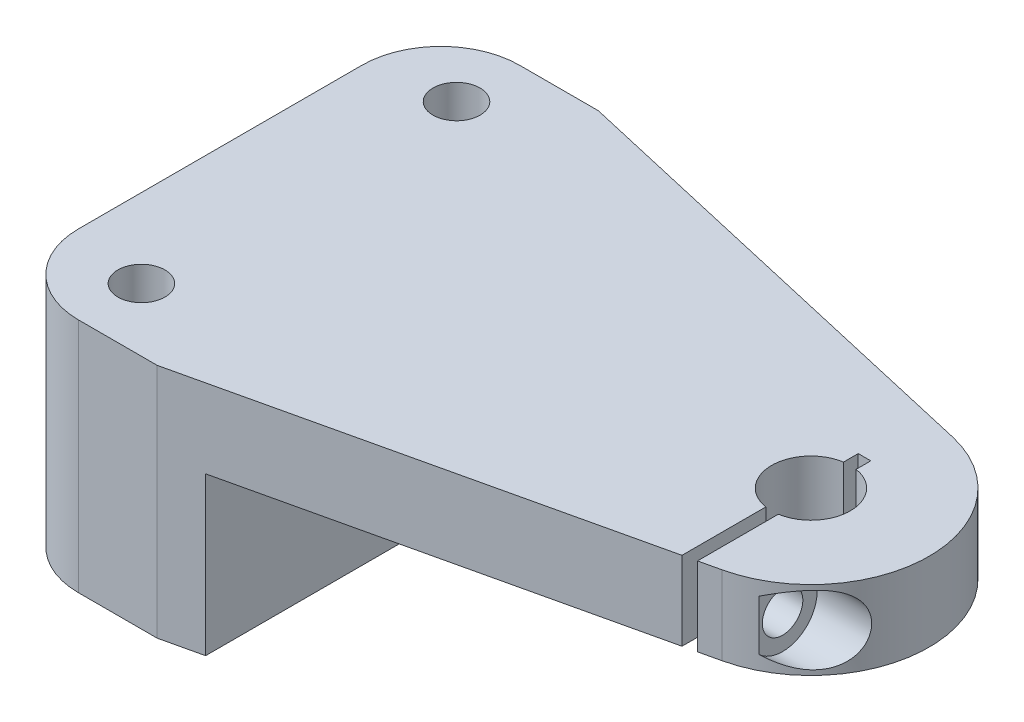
SolidWorks part; units mm, degrees
ref_plane "Front" through (0, 0, 0) normal (0, 0, 1) x (1, 0, 0)
ref_plane "Top" through (0, 0, 0) normal (0, 1, 0) x (1, 0, 0)
ref_plane "Right" through (0, 0, 0) normal (1, 0, 0) x (0, 0, -1)
sketch "Sketch1" plane through (0, 0, 0) normal (0, 1, 0) x (1, 0, 0)
  line L0 (-34.925, 17.78) -> (2.1287, 9.2841)
  line L1 (-47.625, 17.78) -> (-47.625, -17.78)
  line L2 (2.1287, -9.2841) -> (-34.925, -17.78)
  line L3 (0, 0) -> (-47.625, 0) construction
  line L6 (-47.625, 17.78) -> (-34.925, 17.78)
  line L7 (-47.625, -17.78) -> (-34.925, -17.78)
  circle A0 centre (0, 0) radius 3.175
  arc A1 (2.1287, -9.2841) -> (2.1287, 9.2841) centre (0, 0) ccw
  dimension "D1" = 6.35
  dimension "D2" = 47.625
  dimension "D4" = 9.525
  dimension "D3" = 35.56
  dimension "D5" = 12.7
extrude "Extrude1" add sketch "Sketch1" along normal blind 19.05
hole_wizard "#6 Clearance Hole1" positions "Sketch3" profile "Sketch2" hole size "#6" standard "Ansi Inch"
sketch "Sketch3" plane through (0, 19.05, 0) normal (0, 1, 0) x (-1, 0, 0)
  line L0 (0, 0) -> (43.9115, 0) construction
  circle A0 centre (0, 0) radius 3.175 construction
  point P0 (41.275, -12.7)
  point P6 (41.275, 12.7)
  dimension "D1" = 25.4
  dimension "D2" = 41.275
sketch "Sketch2" plane through (-41.275, 19.05, -12.7) normal (1, 0, 0) x (0, 0, 1)
  line L0 (0, 0) -> (0, 19.05)
  line L1 (0, 19.05) -> (1.8986, 19.05)
  line L2 (1.8986, 19.05) -> (1.8986, 0)
  line L5 (1.8986, 0) -> (0, 0)
  line L11 (0, -6.35) -> (0, 107.95) construction
  dimension "Thru Hole Dia." = 3.7973
  dimension "Thru Hole Depth" = 19.05
sketch "Sketch4" plane through (0.8973, 0, 0) normal (0, 0, 1) x (1, 0, 0)
  line L0 (-48.5223, 19.05) -> (-48.5223, 0) construction
  line L1 (-32.6473, 12.7) -> (30.8086, 12.7)
  line L2 (-32.6473, 12.7) -> (-32.6473, -12.5638)
  line L3 (-32.6473, -12.5638) -> (30.8086, -12.5638)
  line L4 (30.8086, 12.7) -> (30.8086, -12.5638)
  line L6 (-35.8223, 19.05) -> (1.2314, 19.05) construction
  dimension "D1" = 15.875
  dimension "D2" = 6.35
extrude "Cut-Extrude1" cut sketch "Sketch4" against normal through all and the other way through all
sketch "Sketch5" plane through (0, 19.05, 0) normal (0, 1, 0) x (-1, 0, 0)
  line L0 (0, 0) -> (0, 18.5345) construction
  line L2 (-0.508, -4.318) -> (0.508, -4.318)
  line L3 (-0.508, -4.318) -> (-0.508, 13.0519)
  line L4 (-0.508, 13.0519) -> (0.508, 13.0519)
  line L5 (0.508, -4.318) -> (0.508, 13.0519)
  dimension "D1" = 1.016
  dimension "D2" = 4.318
extrude "Cut-Extrude2" cut sketch "Sketch5" against normal through all
hole_wizard "#4-40 Tapped Hole1" positions "Sketch7" profile "Sketch6" tap size "#4-40" standard "Ansi Inch"
sketch "Sketch7" plane through (-0.508, 0, 0) normal (1, 0, 0) x (0, 0, -1)
  line L0 (-9.8886, 15.875) -> (0.4848, 15.875) construction
  line L1 (-9.8886, 12.7) -> (-9.8886, 19.05) construction
  point P0 (-6.604, 15.875)
  dimension "D1" = 6.604
sketch "Sketch6" plane through (-0.508, 15.875, 6.604) normal (0, 1, 0) x (0, 0, -1)
  line L0 (0, 0) -> (0, 8.2738)
  line L1 (0, 8.2738) -> (1.1303, 7.5946)
  line L2 (1.1303, 7.5946) -> (1.1303, 0)
  line L5 (1.1303, 0) -> (0, 0)
  line L10 (0, 8.2738) -> (-1.1303, 7.5946) construction
  line L11 (0, -6.35) -> (0, 107.95) construction
  dimension "Tap Drill Dia." = 2.2606
  dimension "Tap Drill Depth" = 7.5946
  dimension "Drill Angle" = 118
ref_plane "Plane1" through (9.398, 0, 0) normal (-1, 0, 0) x (0, 0, 1)
hole_wizard "CBORE for #4 Socket Head Cap Screw1" positions "Sketch9" profile "Sketch8" counterbore size "#4" standard "Ansi Inch"
sketch "Sketch9" plane through (9.398, 0, 0) normal (-1, 0, 0) x (0, 0, 1)
  line L0 (9.8886, 15.875) -> (5.6277, 15.875) construction
  line L1 (9.8886, 12.7) -> (9.8886, 19.05) construction
  point P0 (6.604, 15.875)
  dimension "D1" = 6.604
sketch "Sketch8" plane through (9.398, 15.875, 6.604) normal (0, 1, 0) x (0, 0, -1)
  line L0 (0, 0) -> (0, 8.89)
  line L1 (0, 8.89) -> (1.6319, 8.89)
  line L3 (1.6319, 8.89) -> (1.6319, 5.08)
  line L4 (1.6319, 5.08) -> (2.7788, 5.08)
  line L5 (2.7788, 5.08) -> (2.7788, 0)
  line L7 (2.7788, 0) -> (0, 0)
  line L11 (0, -6.35) -> (0, 107.95) construction
  dimension "Thru Hole Dia." = 3.2639
  dimension "Thru Hole Depth" = 8.89
  dimension "C'Bore Dia." = 5.5575
  dimension "C'Bore Depth" = 5.08
fillet "Fillet1" radius 6.35 2 edges at (-47.625, 9.525, -17.78) (-47.625, 9.525, 17.78)
